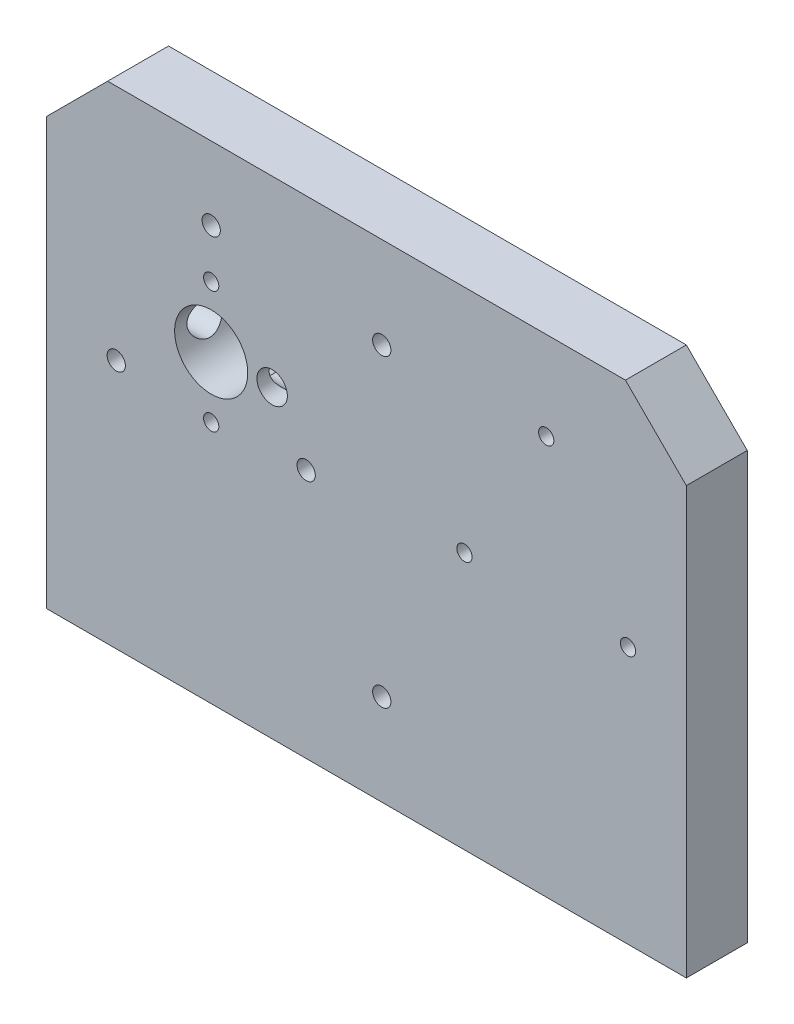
SolidWorks part; units mm, degrees
ref_plane "Front" through (0, 0, 0) normal (0, 0, 1) x (1, 0, 0)
ref_plane "Top" through (0, 0, 0) normal (0, 1, 0) x (1, 0, 0)
ref_plane "Right" through (0, 0, 0) normal (1, 0, 0) x (0, 0, -1)
sketch "Esquisse1" plane through (0, 0, 0) normal (0, 0, 1) x (1, 0, 0)
  line L1 (-52.5, 40) -> (52.5, 40)
  line L2 (-52.5, 40) -> (-52.5, -40)
  line L3 (-52.5, -40) -> (52.5, -40)
  line L4 (52.5, 40) -> (52.5, -40)
  line L5 (-52.5, 40) -> (52.5, -40) construction
  line L6 (-52.5, -40) -> (52.5, 40) construction
  point P0 (0, 0)
  dimension "D1" = 105
  dimension "D2" = 80
extrude "Boss.-Extru.1" add sketch "Esquisse1" along normal blind 10
hole_wizard "Diamètre du perçage Ø0.15 (0.15)1" positions "Esquisse3" profile "Esquisse2" hole size "Ø0.15" standard "Ansi Metric"
sketch "Esquisse3" plane through (0, 0, 10) normal (0, 0, 1) x (1, 0, 0)
  line L0 (-52.5, 40) -> (-52.5, -40) construction
  line L1 (-52.5, -40) -> (52.5, -40) construction
  point P0 (-25.5, 10)
sketch "Esquisse2" plane through (-25.5, 10, 10) normal (1, 0, 0) x (0, -1, 0)
  line L0 (0, 0) -> (0, 10)
  line L1 (0, 10) -> (6, 10)
  line L2 (6, 10) -> (6, 0)
  line L5 (6, 0) -> (0, 0)
  line L11 (0, -6.35) -> (0, 107.95) construction
  dimension "Diamètre du perçage jusqu'au prochain" = 12
  dimension "Profondeur du perçage jusqu'au prochain" = 10
hole_wizard "Diamètre du perçage Ø0.15 (0.15)2" positions "Esquisse5" profile "Esquisse6" hole size "Ø0.15" standard "Ansi Metric"
sketch "Esquisse5" plane through (-52.5, 0, 0) normal (-1, 0, 0) x (0, 0, 1)
  line L0 (0, 40) -> (0, -40) construction
  line L2 (10, -40) -> (0, -40) construction
  point P0 (5, 10)
sketch "Esquisse6" plane through (-52.5, 10, 5) normal (0, 1, 0) x (0, 0, 1)
  line L0 (0, 0) -> (0, 83.8026)
  line L1 (0, 83.8026) -> (3, 82)
  line L2 (3, 82) -> (3, 0)
  line L5 (3, 0) -> (0, 0)
  line L10 (0, 83.8026) -> (-3, 82) construction
  line L11 (0, -6.35) -> (0, 107.95) construction
  dimension "Diamètre du perçage" = 6
  dimension "Profondeur du perçage" = 82
  dimension "Angle de pointe" = 118
hole_wizard "Diamètre du perçage Ø0.15 (0.15)3" positions "Esquisse10" profile "Esquisse9" hole size "Ø0.15" standard "Ansi Metric"
sketch "Esquisse10" plane through (0, 0, 10) normal (0, 0, 1) x (1, 0, 0)
  circle A0 centre (-25.5, 10) radius 6 construction
  point P0 (-15.5, 10)
  dimension "D1" = 10
  dimension "D2" = 0
sketch "Esquisse9" plane through (-15.5, 10, 10) normal (1, 0, 0) x (0, -1, 0)
  line L0 (0, 0) -> (0, 2)
  line L1 (0, 2) -> (2.5, 2)
  line L2 (2.5, 2) -> (2.5, 0)
  line L5 (2.5, 0) -> (0, 0)
  line L11 (0, -6.35) -> (0, 107.95) construction
  dimension "Diamètre du perçage jusqu'au prochain" = 5
  dimension "Profondeur du perçage jusqu'au prochain" = 2
hole_wizard "Trou taraudé M31" positions "Esquisse12" profile "Esquisse11" tap size "M3" standard "ISO"
sketch "Esquisse12" plane through (0, 0, 10) normal (0, 0, 1) x (1, 0, 0)
  circle A0 centre (-25.5, 10) radius 6 construction
  point P0 (-25.5, 0)
  dimension "D1" = 10
  dimension "D2" = 0
sketch "Esquisse11" plane through (-25.5, 0, 10) normal (1, 0, 0) x (0, -1, 0)
  line L0 (0, 0) -> (0, 10.001)
  line L1 (0, 10.001) -> (1.25, 10.001)
  line L2 (1.25, 10.001) -> (1.25, 0)
  line L5 (1.25, 0) -> (0, 0)
  line L11 (0, -6.35) -> (0, 107.95) construction
  dimension "Diamètre du trou pour taraudage jusqu'au prochain" = 2.5
  dimension "Profondeur du trou pour taraudage jusqu'au prochain" = 10.001
pattern_circular "Répétition circulaire1" count 2 over 360 about axis through (-25.5, 10, 0) along (0, 0, 1) of "Trou taraudé M31"
hole_wizard "Diamètre du perçage Ø0.15 (0.15)4" positions "Esquisse14" profile "Esquisse13" hole size "Ø0.15" standard "Ansi Metric"
sketch "Esquisse14" plane through (0, 0, 10) normal (0, 0, 1) x (1, 0, 0)
  circle A0 centre (-25.5, 10) radius 6 construction
  point P0 (-25.5, 28)
  dimension "D1" = 18
sketch "Esquisse13" plane through (-25.5, 28, 10) normal (1, 0, 0) x (0, -1, 0)
  line L0 (0, 0) -> (0, 10.001)
  line L1 (0, 10.001) -> (1.5, 10.001)
  line L2 (1.5, 10.001) -> (1.5, 0)
  line L5 (1.5, 0) -> (0, 0)
  line L11 (0, -6.35) -> (0, 107.95) construction
  dimension "Diamètre du perçage jusqu'au prochain" = 3
  dimension "Profondeur du perçage jusqu'au prochain" = 10.001
pattern_circular "Répétition circulaire2" count 3 over 360 about axis through (-25.5, 10, 0) along (0, 0, 1) of "Diamètre du perçage Ø0.15 (0.15)4"
hole_wizard "Diamètre du perçage Ø0.15 (0.15)5" positions "Esquisse16" profile "Esquisse15" hole size "Ø0.15" standard "Ansi Metric"
sketch "Esquisse16" plane through (0, 0, 0) normal (0, 0, -1) x (-1, 0, 0)
  circle A0 centre (25.5, 10) radius 6 construction
  point P0 (-29.5, 10)
  dimension "D1" = 55
  dimension "D2" = 0
sketch "Esquisse15" plane through (29.5, 10, 0) normal (1, 0, 0) x (0, 1, 0)
  line L0 (0, 0) -> (0, 2)
  line L1 (0, 2) -> (2.5, 2)
  line L2 (2.5, 2) -> (2.5, 0)
  line L5 (2.5, 0) -> (0, 0)
  line L11 (0, -6.35) -> (0, 107.95) construction
  dimension "Diamètre du perçage jusqu'au prochain" = 5
  dimension "Profondeur du perçage jusqu'au prochain" = 2
hole_wizard "Trou taraudé M32" positions "Esquisse18" profile "Esquisse17" tap size "M3" standard "ISO"
sketch "Esquisse18" plane through (0, 0, 0) normal (0, 0, -1) x (-1, 0, 0)
  circle A0 centre (-29.5, 10) radius 2.5 construction
  point P0 (-29.5, 25.5)
  dimension "D1" = 15.5
sketch "Esquisse17" plane through (29.5, 25.5, 0) normal (1, 0, 0) x (0, 1, 0)
  line L0 (0, 0) -> (0, 10.001)
  line L1 (0, 10.001) -> (1.25, 10.001)
  line L2 (1.25, 10.001) -> (1.25, 0)
  line L5 (1.25, 0) -> (0, 0)
  line L11 (0, -6.35) -> (0, 107.95) construction
  dimension "Diamètre du trou pour taraudage jusqu'au prochain" = 2.5
  dimension "Profondeur du trou pour taraudage jusqu'au prochain" = 10.001
pattern_circular "Répétition circulaire3" count 3 over 360 about axis through (29.5, 10, 0) along (0, 0, 1) of "Trou taraudé M32"
hole_wizard "Diamètre du perçage Ø0.15 (0.15)6" positions "Esquisse20" profile "Esquisse19" hole size "Ø0.15" standard "Ansi Metric"
sketch "Esquisse20" plane through (0, 0, 10) normal (0, 0, 1) x (1, 0, 0)
  line L0 (-52.5, -40) -> (52.5, -40) construction
  line L1 (-52.5, 40) -> (-52.5, -40) construction
  point P0 (2.5, -25)
  point P2 (2.5, 25)
  dimension "D1" = 15
  dimension "D2" = 50
  dimension "D3" = 55
sketch "Esquisse19" plane through (2.5, -25, 10) normal (1, 0, 0) x (0, -1, 0)
  line L0 (0, 0) -> (0, 10)
  line L1 (0, 10) -> (1.5, 10)
  line L2 (1.5, 10) -> (1.5, 0)
  line L5 (1.5, 0) -> (0, 0)
  line L11 (0, -6.35) -> (0, 107.95) construction
  dimension "Diamètre du perçage jusqu'au prochain" = 3
  dimension "Profondeur du perçage jusqu'au prochain" = 10
hole_wizard "Trou taraudé M41" positions "Esquisse22" profile "Esquisse21" tap size "M4" standard "ISO"
sketch "Esquisse22" plane through (0, -40, 0) normal (0, -1, 0) x (-1, 0, 0)
  line L0 (52.5, -10) -> (52.5, 0) construction
  line L1 (52.5, 0) -> (-52.5, 0) construction
  point P0 (37.5, -5)
  point P2 (-37.5, -5)
  dimension "D1" = 15
  dimension "D2" = 5
  dimension "D3" = 75
  dimension "D4" = 5
sketch "Esquisse21" plane through (-37.5, -40, 5) normal (1, 0, 0) x (0, 0, -1)
  line L0 (0, 0) -> (0, 18.9914)
  line L1 (0, 18.9914) -> (1.65, 18)
  line L2 (1.65, 18) -> (1.65, 0)
  line L5 (1.65, 0) -> (0, 0)
  line L10 (0, 18.9914) -> (-1.65, 18) construction
  line L11 (0, -6.35) -> (0, 107.95) construction
  dimension "Diamètre du trou pour taraudage" = 3.3
  dimension "Profondeur du trou pour taraudage" = 18
  dimension "Angle de pointe" = 118
hole_wizard "Trou taraudé M2.51" positions "Esquisse25" profile "Esquisse24" tap size "M2.5" standard "ISO"
sketch "Esquisse25" plane through (-52.5, 0, 0) normal (-1, 0, 0) x (0, 0, 1)
  line L0 (10, 40) -> (10, -40) construction
  circle A0 centre (5, 10) radius 3 construction
  point P0 (5, 15)
  point P2 (5, 5)
sketch "Esquisse24" plane through (-52.5, 15, 5) normal (0, 1, 0) x (0, 0, 1)
  line L0 (0, 0) -> (0, 6.6159)
  line L1 (0, 6.6159) -> (1.025, 6)
  line L2 (1.025, 6) -> (1.025, 0)
  line L5 (1.025, 0) -> (0, 0)
  line L10 (0, 6.6159) -> (-1.025, 6) construction
  line L11 (0, -6.35) -> (0, 107.95) construction
  dimension "Diamètre du trou pour taraudage" = 2.05
  dimension "Profondeur du trou pour taraudage" = 6
  dimension "Angle de pointe" = 118
chamfer "Chanfrein1" distance 10 angle 45 2 edges at (-52.5, 40, 5) (52.5, 40, 5)
equation "\"D2@Esquisse5\"=\"D2@Esquisse3\""
equation "\"D3@Esquisse25\"=\"D4@Esquisse25\""
